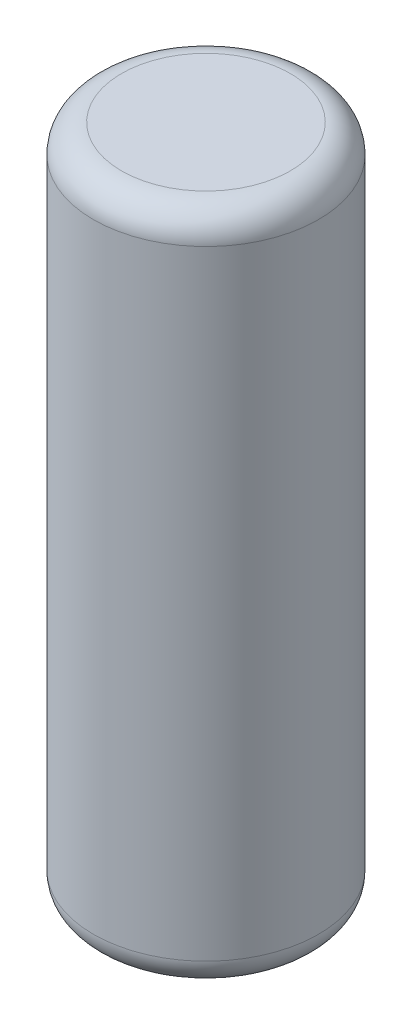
SolidWorks part; units mm, degrees
ref_plane "Спереди" through (0, 0, 0) normal (0, 0, 1) x (1, 0, 0)
ref_plane "Сверху" through (0, 0, 0) normal (0, 1, 0) x (1, 0, 0)
ref_plane "Справа" through (0, 0, 0) normal (1, 0, 0) x (0, 0, -1)
sketch "Эскиз1" plane through (0, 0, 0) normal (0, 1, 0) x (1, 0, 0)
  circle A0 centre (0, 0) radius 2
  dimension "D1" = 4
extrude "Бобышка-Вытянуть1" add sketch "Эскиз1" along normal mid plane 12
fillet "Скругление1" radius 0.5 2 edges at (0, -6, 2) (0, 6, 2)
